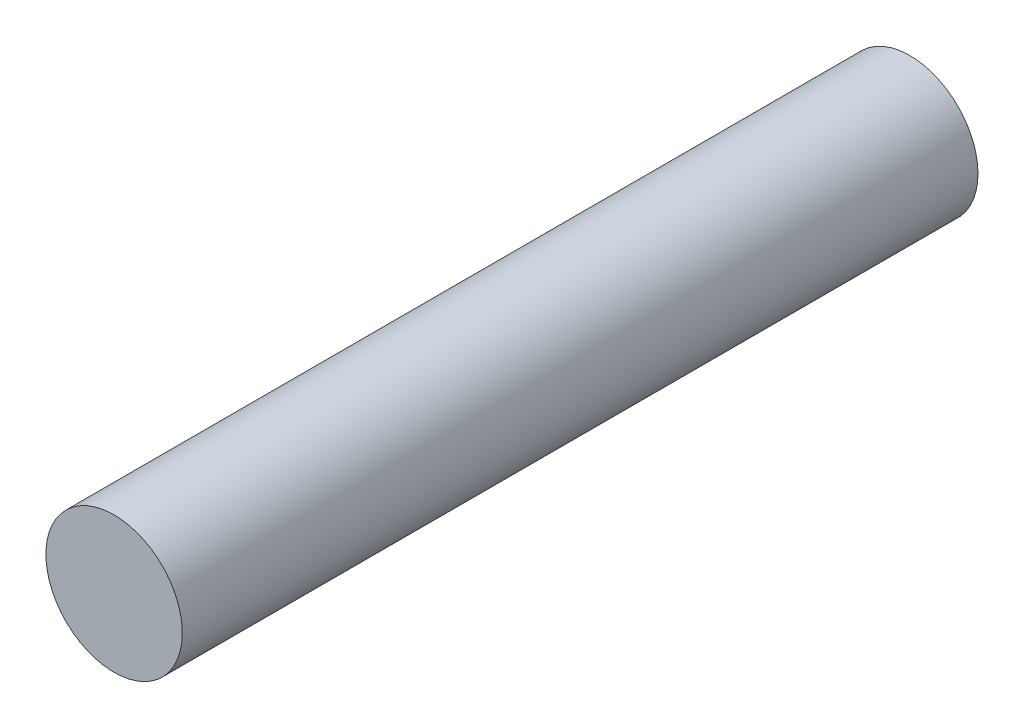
SolidWorks part; units mm, degrees
ref_plane "Front Plane" through (0, 0, 0) normal (0, 0, 1) x (1, 0, 0)
ref_plane "Top Plane" through (0, 0, 0) normal (0, 1, 0) x (1, 0, 0)
ref_plane "Right Plane" through (0, 0, 0) normal (1, 0, 0) x (0, 0, -1)
sketch "Sketch1" plane through (0, 0, 0) normal (0, 0, 1) x (1, 0, 0)
  circle A0 centre (0, 0) radius 30
  dimension "D1" = 60
extrude "Boss-Extrude1" add sketch "Sketch1" against normal blind 350
